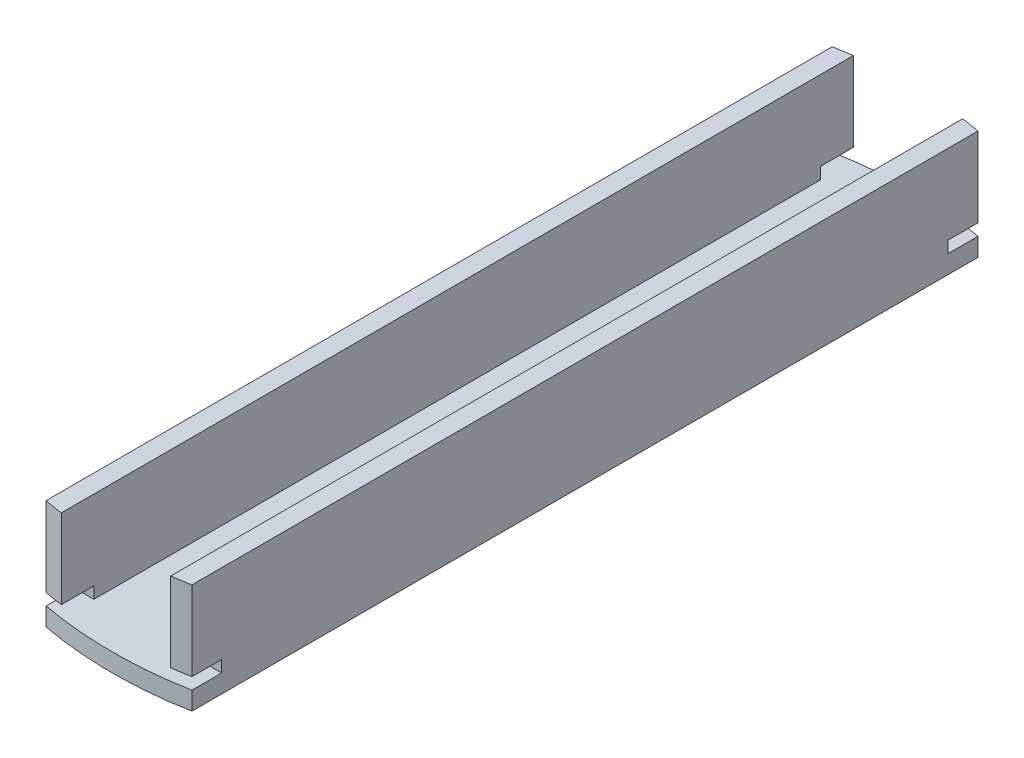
SolidWorks part; units mm, degrees
ref_plane "Plane1" through (0, 0, 0) normal (0, 0, 1) x (1, 0, 0)
ref_plane "Plane2" through (0, 0, 0) normal (0, 1, 0) x (1, 0, 0)
ref_plane "Plane3" through (0, 0, 0) normal (1, 0, 0) x (0, 0, -1)
sketch "Sketch1" plane through (0, 0, 0) normal (0, 0, 1) x (1, 0, 0)
  line L1 (0, 0) -> (25.4, 0)
  line L2 (0, 0) -> (0, 19.05)
  line L3 (0, 19.05) -> (25.4, 19.05)
  line L4 (25.4, 0) -> (25.4, 19.05)
extrude "Base-Extrude" add sketch "Sketch1" along normal blind 139.192
sketch "Sketch2" plane through (0, 0, 139.192) normal (0, 0, 1) x (1, 0, 0)
  line L1 (3.175, 19.05) -> (3.175, 3.175)
  line L2 (3.175, 3.175) -> (22.225, 3.175)
  line L3 (22.225, 3.175) -> (22.225, 19.05)
  line L4 (22.225, 19.05) -> (3.175, 19.05)
extrude "Cut-Extrude1" cut sketch "Sketch2" against normal through all
sketch "Sketch3" plane through (0, 0, 0) normal (0, -1, 0) x (1, 0, 0)
  circle A0 centre (12.7, 69.596) radius 3.2639
extrude "Cut-Extrude2" cut sketch "Sketch3" against normal blind 139.192
sketch "Sketch4" plane through (0, 0, 0) normal (0, -1, 0) x (1, 0, 0)
  line L0 (25.4, 138.0234) -> (25.4, 1.1686)
  line L1 (0, 138.0234) -> (0, 1.1686)
  arc A0 (25.4, 138.0234) -> (0, 138.0234) centre (12.7, 69.596) ccw
  arc A1 (0, 1.1686) -> (25.4, 1.1686) centre (12.7, 69.596) ccw
extrude "Cut-Extrude6" cut sketch "Sketch4" against normal through all flip side to cut
sketch "Sketch7" plane through (25.4, 0, 0) normal (1, 0, 0) x (0, 0, -1)
  line L0 (-138.5371, 3.175) -> (-139.192, 3.175) construction
  line L1 (-139.192, 3.175) -> (-132.842, 3.175)
  line L2 (-139.192, 3.175) -> (-139.192, 5.207)
  line L3 (-139.192, 5.207) -> (-132.842, 5.207)
  line L4 (-132.842, 3.175) -> (-132.842, 5.207)
  line L5 (-69.596, 20.5495) -> (-69.596, -5.1542) construction
  line L6 (-69.596, 3.175) -> (-69.596, 0) construction
  line L7 (-6.35, 3.175) -> (-6.35, 5.207)
  line L8 (0, 5.207) -> (-6.35, 5.207)
  line L9 (0, 3.175) -> (0, 5.207)
  line L10 (0, 3.175) -> (-6.35, 3.175)
extrude "Cut-Extrude7" cut sketch "Sketch7" against normal through all
